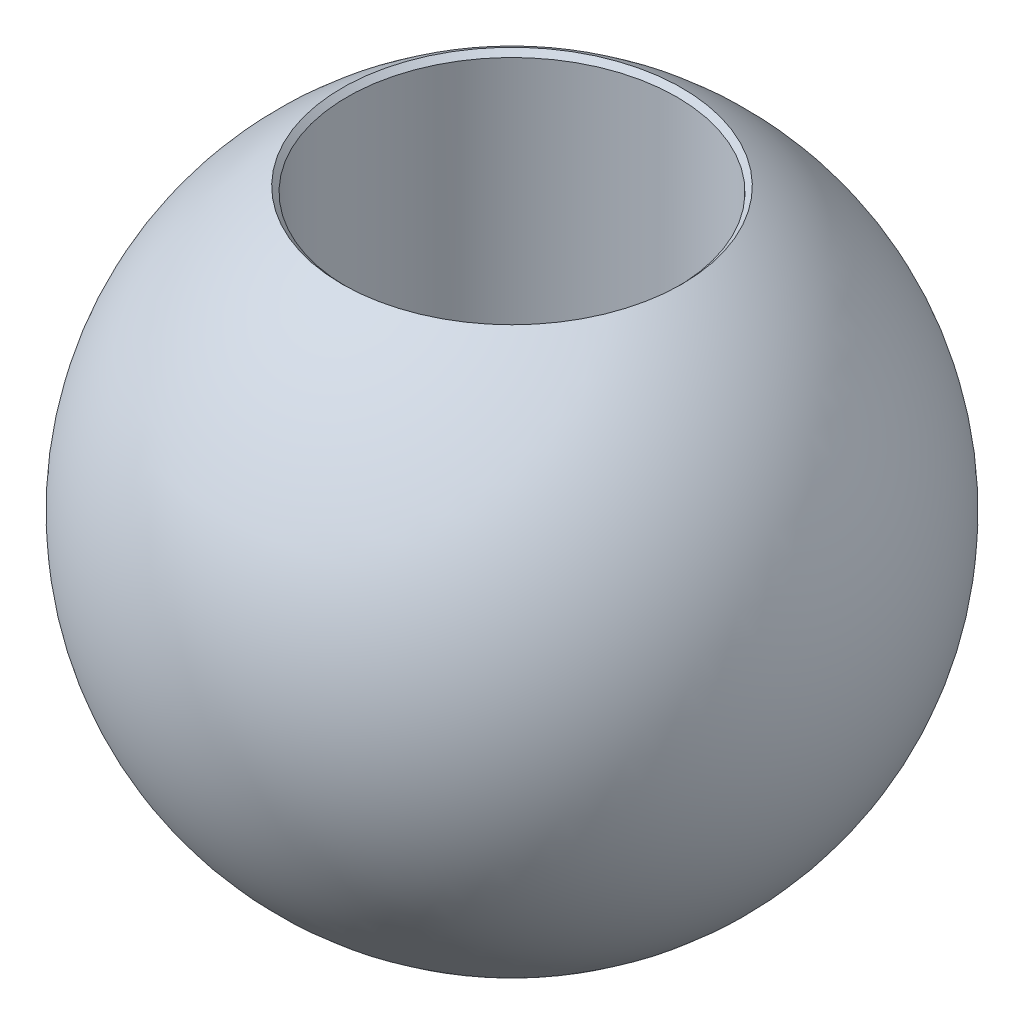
SolidWorks part; units mm, degrees
ref_plane "Face" through (0, 0, 0) normal (0, 0, 1) x (1, 0, 0)
ref_plane "Dessus" through (0, 0, 0) normal (0, 1, 0) x (1, 0, 0)
ref_plane "Droite" through (0, 0, 0) normal (1, 0, 0) x (0, 0, -1)
sketch "Esquisse1" plane through (0, 0, 0) normal (0, 0, 1) x (1, 0, 0)
  line L0 (0, 8) -> (0, -8)
  line L1 (0, 24.649) -> (0, -18.768) construction
  arc A0 (0, -8) -> (0, 8) centre (0, 0) ccw
  point P4 (0, 0)
  point P7 (0, 0)
  dimension "D1" = 16
revolve "Base-Révolution" add sketch "Esquisse1" angle 360 about L1
sketch "Esquisse2" plane through (0, 0, 0) normal (0, 1, 0) x (1, 0, 0)
  circle A0 centre (0, 0) radius 4
  dimension "D1" = 8
extrude "Enlèv. mat.-Extru.1" cut sketch "Esquisse2" against normal through all and the other way through all
chamfer "Chanfrein1" distance 0.2 angle 45
